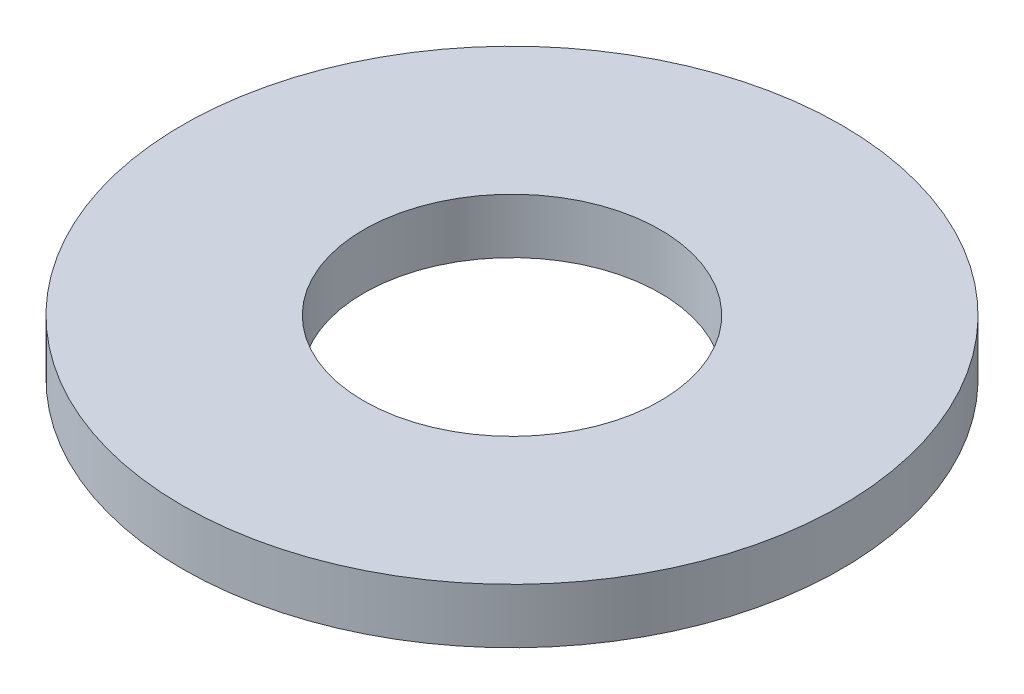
SolidWorks part; units mm, degrees
ref_plane "Front" through (0, 0, 0) normal (0, 0, 1) x (1, 0, 0)
ref_plane "Top" through (0, 0, 0) normal (0, 1, 0) x (1, 0, 0)
ref_plane "Right" through (0, 0, 0) normal (1, 0, 0) x (0, 0, -1)
sketch "Sketch1" plane through (0, 0, 0) normal (0, 1, 0) x (1, 0, 0)
  circle A0 centre (0, 0) radius 1.35
  circle A1 centre (0, 0) radius 3
extrude "Extrude1" add sketch "Sketch1" along normal blind 0.5
